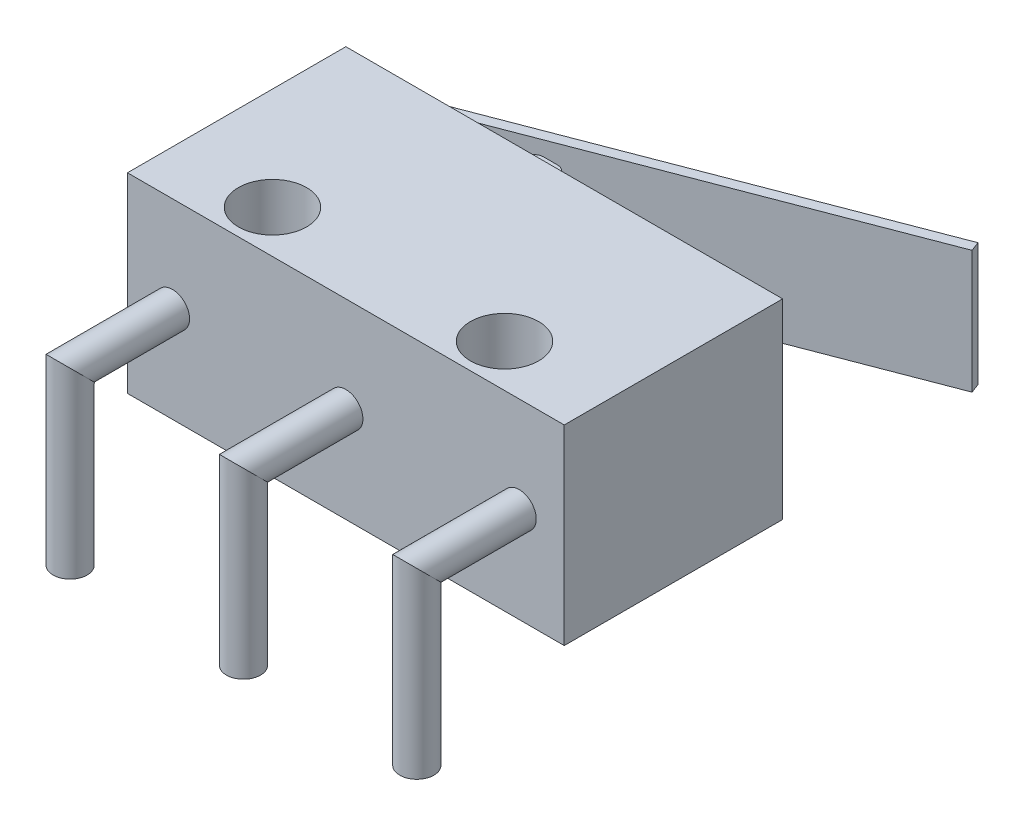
SolidWorks part; units mm, degrees
ref_plane "Plan de face" through (0, 0, 0) normal (0, 0, 1) x (1, 0, 0)
ref_plane "Plan de dessus" through (0, 0, 0) normal (0, 1, 0) x (1, 0, 0)
ref_plane "Plan de droite" through (0, 0, 0) normal (1, 0, 0) x (0, 0, -1)
sketch "Esquisse1" plane through (0, 0, 0) normal (0, 1, 0) x (1, 0, 0)
  line L0 (0, -2.5006) -> (0, 15.2598) construction
  line L1 (0, 0) -> (12.8, 0)
  line L2 (0, 0) -> (0, 6.4)
  line L3 (0, 6.4) -> (12.8, 6.4)
  line L4 (12.8, 0) -> (12.8, 6.4)
  line L5 (-3.2154, 0) -> (26.8884, 0) construction
  line L6 (-3.2154, 1.25) -> (4.1722, 1.25) construction
  line L7 (3, -2.1046) -> (3, 2.4602) construction
  line L8 (6.4, 8.6166) -> (6.4, -2.5006) construction
  circle A0 centre (3, 1.25) radius 1
  circle A1 centre (9.8, 1.25) radius 1
  dimension "D1" = 6.4
  dimension "D2" = 3
  dimension "D3" = 1.25
extrude "Extrusion1" add sketch "Esquisse1" along normal blind 5.6
sketch "Esquisse2" plane through (0, 0, -6.4) normal (0, 0, -1) x (-1, 0, 0)
  line L0 (0.4551, 0) -> (-13.6057, 0) construction
  line L1 (0.4551, 2.8) -> (-12.1307, 2.8) construction
  line L2 (-0.2945, 1.4) -> (-7.4277, 1.4) construction
  line L3 (-0.2945, 4.2) -> (-6.6176, 4.2) construction
  line L4 (-4, -0.8935) -> (-4, 6.1671) construction
  line L5 (-5, -0.8935) -> (-5, 6.1671) construction
  line L6 (0, -0.7605) -> (0, 6.3847) construction
  line L8 (-4, 1.4) -> (-5, 1.4)
  line L9 (-4, 1.4) -> (-4, 4.2)
  line L10 (-4, 4.2) -> (-5, 4.2)
  line L11 (-5, 1.4) -> (-5, 4.2)
  dimension "D1" = 2.8
  dimension "D2" = 1
  dimension "D3" = 4
  dimension "D4" = 1.4
  dimension "D5" = 2.8
extrude "Extrusion2" add sketch "Esquisse2" along normal blind 1.5
fillet "Congé1" radius 0.3 2 edges at (5, 2.8, -7.9) (4, 2.8, -7.9)
ref_plane "Plan1" through (0, 2.8, 0) normal (0, 1, 0) x (-1, 0, 0)
sketch "Esquisse3" plane through (0, 0, -6.4) normal (0, 0, -1) x (-1, 0, 0)
  line L0 (0, -0.3651) -> (0, 6.1788) construction
  line L1 (-1, 6.1788) -> (-1, -0.3651) construction
  line L2 (0.1805, 4.6) -> (-3.7968, 4.6) construction
  line L3 (-1.3, 6.1788) -> (-1.3, -0.4631) construction
  line L4 (0.6899, 1) -> (-3.6107, 1) construction
  line L5 (1.0426, 0) -> (-4.9724, 0) construction
  line L6 (-12.8, 5.6) -> (0, 5.6) construction
  line L8 (-1.3, 4.6) -> (-1, 4.6)
  line L9 (-1.3, 4.6) -> (-1.3, 1)
  line L10 (-1.3, 1) -> (-1, 1)
  line L11 (-1, 4.6) -> (-1, 1)
  dimension "D1" = 1
  dimension "D2" = 1
  dimension "D3" = 1
  dimension "D4" = 0.3
sketch "Esquisse4" plane through (0, 2.8, 0) normal (0, 1, 0) x (-1, 0, 0)
  line L0 (0, -9.202) -> (0, -2.699) construction
  line L1 (-1.15, -8.2386) -> (-1.15, -6.4) construction
  line L2 (1.2182, -6.9) -> (-1.7523, -6.9) construction
  line L3 (0.1805, -6.4) -> (-3.7968, -6.4) construction
  line L4 (-1.15, -6.9) -> (-13.2907, -11.5479) construction
  line L5 (2.1257, -6.4) -> (-7.3425, -6.4) construction
  line L6 (-1.15, -6.4) -> (-1.15, -6.728)
  line L7 (-1.3106, -6.9615) -> (-13.2907, -11.5479)
  arc A0 (-1.15, -6.728) -> (-1.3106, -6.9615) centre (-1.4, -6.728) cw
  dimension "D4" = 0.25
  dimension "D1" = 1.15
  dimension "D2" = 0.5
  dimension "D3" = 13
sweep "Balayage1" add profiles "Esquisse3" path "Esquisse4"
sketch "Esquisse6" plane through (0, 0, 0) normal (0, 0, 1) x (1, 0, 0)
  line L0 (-1.1647, 2.8) -> (15.3638, 2.8) construction
  line L1 (6.4, 7.4371) -> (6.4, -1.9171) construction
  line L2 (1.32, 7.4371) -> (1.32, -1.9171) construction
  line L3 (0, 5.6) -> (0, 0) construction
  line L4 (0, 5.6) -> (12.8, 5.6) construction
  circle A0 centre (6.4, 2.8) radius 0.5
  circle A1 centre (1.32, 2.8) radius 0.5
  circle A2 centre (11.48, 2.8) radius 0.5
  dimension "D1" = 6.4
  dimension "D2" = 2.8
  dimension "D3" = 5.08
ref_plane "Plan2" through (6.4, 0, 0) normal (1, 0, 0) x (0, 0, -1)
sketch "Esquisse7" plane through (6.4, 0, 0) normal (1, 0, 0) x (0, 0, -1)
  line L0 (13.674, 2.8) -> (-9.9951, 2.8) construction
  line L1 (2.8524, -2.2) -> (-9.9951, -2.2) construction
  line L2 (-3, -4.6876) -> (-3, 5.5163) construction
  line L3 (0, 8.8765) -> (0, -5.157) construction
  line L4 (0, 2.8) -> (-3, 2.8)
  line L5 (-3, 2.8) -> (-3, -2.2)
  dimension "D1" = 3
  dimension "D2" = 5
sweep "Balayage2" add profiles "Esquisse6" path "Esquisse7"
